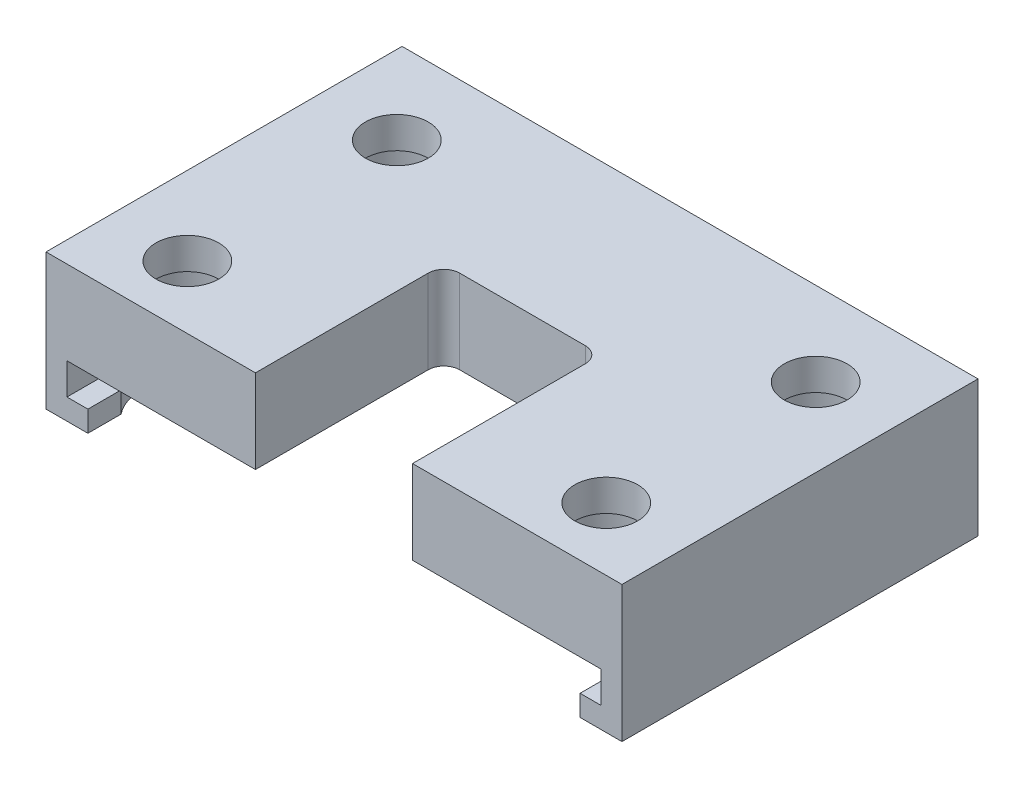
SolidWorks part; units mm, degrees
ref_plane "Alzado" through (0, 0, 0) normal (0, 0, 1) x (1, 0, 0)
ref_plane "Planta" through (0, 0, 0) normal (0, 1, 0) x (1, 0, 0)
ref_plane "Vista lateral" through (0, 0, 0) normal (1, 0, 0) x (0, 0, -1)
ref_plane "Plano1" through (0, 3.05, 0) normal (0, -1, 0) x (1, 0, 0)
sketch "Croquis1" plane through (0, 3.05, 0) normal (0, -1, 0) x (1, 0, 0)
  line L0 (55, 31) -> (0, 31)
  line L1 (0, 31) -> (0, 0)
  line L2 (0, 0) -> (55, 0)
  line L3 (55, 0) -> (55, 31)
  dimension "D1" = 31
  dimension "D2" = 55
extrude "Saliente-Extruir1" add sketch "Croquis1" against normal blind 8
ref_plane "Plano2" through (0, 0, 25.5) normal (0, 0, 1) x (1, 0, 0)
sketch "Croquis2" plane through (0, 0, 25.5) normal (0, 0, 1) x (1, 0, 0)
  line L0 (0, 3.05) -> (0, -1.95)
  line L1 (0, -1.95) -> (4, -1.95)
  line L2 (4, -1.95) -> (4, 0.05)
  line L3 (4, 0.05) -> (2, 0.05)
  line L4 (2, 0.05) -> (2, 3.05)
  line L5 (2, 3.05) -> (0, 3.05)
  line L6 (0, 11.05) -> (0, 3.05) construction
  line L7 (55, 3.05) -> (0, 3.05) construction
  line L8 (27.5, 11.05) -> (27.5, -1.0251) construction
  line L9 (55, 11.05) -> (0, 11.05) construction
  line L10 (55, -1.95) -> (51, -1.95)
  line L11 (51, -1.95) -> (51, 0.05)
  line L12 (51, 0.05) -> (53, 0.05)
  line L13 (53, 0.05) -> (53, 3.05)
  line L14 (53, 3.05) -> (55, 3.05)
  line L15 (55, 3.05) -> (55, -1.95)
  dimension "D1" = 4
  dimension "D2" = 2
  dimension "D3" = 3
  dimension "D4" = 5
extrude "Saliente-Extruir2" add sketch "Croquis2" against normal blind 25.5 and the other way up to vertex (5.5 mm away)
sketch "Croquis3" plane through (0, 0, 31) normal (0, 0, 1) x (1, 0, 0)
  line L0 (55, 11.05) -> (55, 3.05)
  line L1 (55, 3.05) -> (0, 3.05)
  line L2 (0, 3.05) -> (0, 11.05)
  line L3 (0, 11.05) -> (55, 11.05)
  line L4 (0, 11.05) -> (0, -1.95) construction
  line L5 (55, 11.05) -> (55, -1.95) construction
  line L7 (55, 11.05) -> (0, 11.05) construction
  line L8 (53, 3.05) -> (2, 3.05) construction
extrude "Saliente-Extruir3" add sketch "Croquis3" along normal blind 4
sketch "Croquis6" plane through (0, 11.05, 0) normal (0, 1, 0) x (-1, 0, 0)
  line L1 (-35, 34) -> (-35, 16)
  line L2 (-35, 16) -> (-20, 16)
  line L3 (-20, 16) -> (-20, 34)
  line L4 (0, 35) -> (0, 0) construction
  line L5 (-55, 0) -> (-55, 35) construction
  line L7 (-20, 34) -> (0, 34)
  line L8 (-55, 35) -> (0, 35)
  line L9 (-55, 35) -> (-55, 34)
  line L10 (-55, 34) -> (-35, 34)
  line L11 (0, 35) -> (0, 34)
  dimension "D1" = 20
  dimension "D2" = 20
  dimension "D4" = 1
extrude "Cortar-Extruir1" cut sketch "Croquis6" against normal through all
hole_wizard "Taladro1" positions "Croquis8" profile "Croquis7" legacy
sketch "Croquis8" plane through (0, 3.05, 0) normal (0, -1, 0) x (-1, 0, 0)
  line L0 (-20, -16) -> (-35, -16) construction
  line L1 (-2, 0) -> (-53, 0) construction
  point P0 (-7.5, -8)
  point P1 (-47.5, -8)
  point P3 (-7.5, -28)
  point P4 (-47.5, -28)
  point P17 (-27.5, -16)
  dimension "D1" = 40
  dimension "D2" = 20
  dimension "D3" = 20
  dimension "D4" = 8
sketch "Croquis7" plane through (7.5, 3.05, 8) normal (1, 0, 0) x (0, 0, -1)
  line L0 (0, 0) -> (0, 8)
  line L1 (0, 8) -> (3, 8)
  line L2 (3, 8) -> (3, 5)
  line L3 (3, 5) -> (4.5, 5)
  line L4 (4.5, 5) -> (4.5, 0)
  line L5 (4.5, 0) -> (0, 0)
  line L6 (0, 110) -> (0, -10) construction
  dimension "Diámetro" = 6
  dimension "Profundidad" = 8
  dimension "Diámetro de refrentado 1" = 9
  dimension "Profundidad de refrentado 1" = 5
fillet "Redondeo1" radius 1.5 2 edges at (20, 7.05, 16) (35, 7.05, 16)
sketch "Croquis9" plane through (0, -1.95, 0) normal (0, -1, 0) x (1, 0, 0)
  circle A0 centre (7.5, 28) radius 4.5
  circle A1 centre (47.5, 28) radius 4.5
  circle A2 centre (47.5, 8) radius 4.5
  circle A3 centre (7.5, 8) radius 4.5
  dimension "D1" = 9
  dimension "D2" = 9
  dimension "D3" = 9
  dimension "D4" = 9
extrude "Cortar-Extruir2" cut sketch "Croquis9" against normal up to vertex (2 mm away)
sketch "Croquis13" plane through (0, 0, 31) normal (0, 0, 1) x (1, 0, 0)
  line L0 (55, 3.05) -> (53, 3.05)
  line L1 (53, 3.05) -> (53, 0.05)
  line L2 (53, 0.05) -> (51, 0.05)
  line L3 (51, 0.05) -> (51, -1.95)
  line L4 (51, -1.95) -> (55, -1.95)
  line L5 (55, -1.95) -> (55, 3.05)
  line L6 (2, 3.05) -> (0, 3.05)
  line L7 (0, 3.05) -> (0, -1.95)
  line L8 (0, -1.95) -> (4, -1.95)
  line L9 (4, -1.95) -> (4, 0.05)
  line L10 (4, 0.05) -> (2, 0.05)
  line L11 (2, 0.05) -> (2, 3.05)
extrude "Saliente-Extruir5" add sketch "Croquis13" along normal up to vertex (3 mm away)
